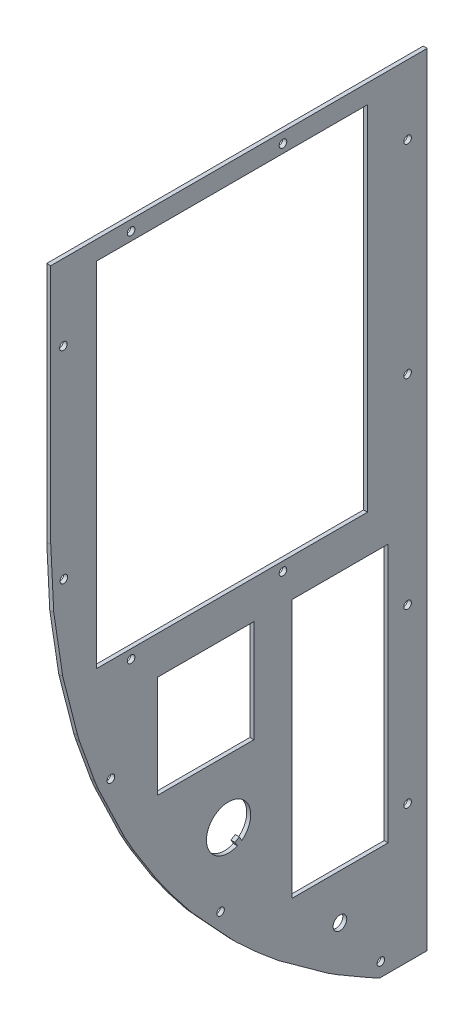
SolidWorks part; units mm, degrees
ref_plane "Front Plane" through (0, 0, 0) normal (0, 0, 1) x (1, 0, 0)
ref_plane "Top Plane" through (0, 0, 0) normal (0, 1, 0) x (1, 0, 0)
ref_plane "Right Plane" through (0, 0, 0) normal (1, 0, 0) x (0, 0, -1)
imported_body "Imported3"
sketch "Sketch24" plane through (907.5363, 0, 0) normal (1, 0, 0) x (0, 0, -1)
  line L0 (-956.7646, 777.5826) -> (-956.7646, 357.4852) construction
  line L1 (-767.8712, 86.5849) -> (-766.2647, 86.5849)
  line L2 (-766.2647, 1048.4829) -> (-766.2647, 86.5849) construction
  line L3 (-766.2647, 86.5849) -> (-766.2647, 478.6339)
  line L16 (-854.845, 273.0129) -> (-854.845, 221.7042)
  line L22 (-854.845, 273.0129) -> (-903.105, 273.0129)
  line L36 (-797.8333, 469.1092) -> (-933.7233, 469.1092)
  line L38 (-903.105, 273.0129) -> (-903.105, 221.7042)
  line L40 (-865.7783, 292.0712) -> (-797.8333, 292.0712)
  line L41 (-865.7783, 292.0712) -> (-933.7233, 292.0712)
  line L43 (-853.0265, 1006.6617) -> (-863.5566, 996.9724)
  line L44 (-863.5566, 996.9724) -> (-865.1657, 995.4091)
  line L45 (-865.1657, 995.4091) -> (-885.7523, 973.1495)
  line L46 (-885.7523, 973.1495) -> (-887.2237, 971.377)
  line L47 (-887.2237, 971.377) -> (-896.3096, 959.7875)
  line L48 (-896.3096, 959.7875) -> (-904.0256, 948.9546)
  line L49 (-904.0256, 948.9546) -> (-919.8046, 923.064)
  line L50 (-919.8046, 923.064) -> (-922.9859, 917.0477)
  line L51 (-922.9859, 917.0477) -> (-932.9332, 895.7338)
  line L52 (-932.9332, 895.7338) -> (-934.7132, 891.4084)
  line L53 (-934.7132, 891.4084) -> (-942.3243, 870.2883)
  line L54 (-942.3243, 870.2883) -> (-943.2817, 867.2344)
  line L55 (-943.2817, 867.2344) -> (-950.7474, 837.8479)
  line L56 (-950.7474, 837.8479) -> (-955.2566, 807.8651)
  line L57 (-955.2566, 807.8651) -> (-956.7646, 777.5826)
  line L58 (-956.7646, 777.5826) -> (-956.7646, 357.4852)
  line L59 (-956.7646, 357.4852) -> (-955.2566, 327.2027)
  line L60 (-955.2566, 327.2027) -> (-950.7474, 297.2199)
  line L61 (-950.7474, 297.2199) -> (-943.2817, 267.8334)
  line L62 (-943.2817, 267.8334) -> (-942.3243, 264.7796)
  line L63 (-942.3243, 264.7796) -> (-934.7132, 243.6594)
  line L64 (-934.7132, 243.6594) -> (-932.9332, 239.3341)
  line L65 (-932.9332, 239.3341) -> (-919.8046, 212.0039)
  line L66 (-919.8046, 212.0039) -> (-914.9366, 203.3787)
  line L67 (-914.9366, 203.3787) -> (-904.0256, 186.1132)
  line L68 (-904.0256, 186.1132) -> (-896.3096, 175.2803)
  line L69 (-896.3096, 175.2803) -> (-887.2237, 163.6908)
  line L70 (-887.2237, 163.6908) -> (-885.7523, 161.9184)
  line L71 (-885.7523, 161.9184) -> (-865.1657, 139.6587)
  line L72 (-865.1657, 139.6587) -> (-863.5566, 138.0954)
  line L73 (-863.5566, 138.0954) -> (-853.0265, 128.4062)
  line L74 (-853.0265, 128.4062) -> (-842.4693, 119.5545)
  line L75 (-842.4693, 119.5545) -> (-817.888, 101.8047)
  line L76 (-817.888, 101.8047) -> (-812.6938, 98.508)
  line L77 (-812.6938, 98.508) -> (-796.6892, 89.2356)
  line L78 (-796.6892, 89.2356) -> (-791.6647, 86.5849)
  line L79 (-791.6647, 86.5849) -> (-767.8712, 86.5849)
  line L80 (-767.8712, 86.5849) -> (-767.8712, 1048.4829)
  line L81 (-767.8712, 1048.4829) -> (-791.6647, 1048.4829)
  line L82 (-791.6647, 1048.4829) -> (-812.6938, 1036.5598)
  line L83 (-812.6938, 1036.5598) -> (-817.888, 1033.2631)
  line L84 (-817.888, 1033.2631) -> (-842.4693, 1015.5133)
  line L85 (-842.4693, 1015.5133) -> (-853.0265, 1006.6617)
  line L101 (-956.7646, 478.6339) -> (-956.7646, 357.4852)
  line L102 (-956.7646, 357.4852) -> (-955.2566, 327.2027)
  line L103 (-955.2566, 327.2027) -> (-950.7474, 297.2199)
  line L104 (-950.7474, 297.2199) -> (-943.2817, 267.8334)
  line L105 (-943.2817, 267.8334) -> (-942.3243, 264.7796)
  line L106 (-942.3243, 264.7796) -> (-934.7132, 243.6594)
  line L107 (-934.7132, 243.6594) -> (-932.9332, 239.3341)
  line L108 (-932.9332, 239.3341) -> (-919.8046, 212.0039)
  line L109 (-919.8046, 212.0039) -> (-914.9366, 203.3787)
  line L110 (-914.9366, 203.3787) -> (-904.0256, 186.1132)
  line L111 (-904.0256, 186.1132) -> (-896.3096, 175.2803)
  line L112 (-896.3096, 175.2803) -> (-887.2237, 163.6908)
  line L113 (-887.2237, 163.6908) -> (-885.7523, 161.9184)
  line L114 (-885.7523, 161.9184) -> (-865.1657, 139.6587)
  line L115 (-865.1657, 139.6587) -> (-863.5566, 138.0954)
  line L116 (-863.5566, 138.0954) -> (-853.0265, 128.4062)
  line L117 (-853.0265, 128.4062) -> (-842.4693, 119.5545)
  line L118 (-842.4693, 119.5545) -> (-817.888, 101.8047)
  line L119 (-817.888, 101.8047) -> (-812.6938, 98.508)
  line L120 (-812.6938, 98.508) -> (-796.6892, 89.2356)
  line L121 (-796.6892, 89.2356) -> (-791.6647, 86.5849)
  line L122 (-791.6647, 86.5849) -> (-767.8712, 86.5849)
  line L129 (-933.7233, 292.0712) -> (-933.7233, 469.1092)
  line L130 (-797.8333, 292.0712) -> (-797.8333, 469.1092)
  line L134 (-835.7989, 273.0214) -> (-787.5157, 273.0214)
  line L135 (-903.105, 221.7042) -> (-854.845, 221.7042)
  line L136 (-835.7989, 143.2274) -> (-787.5389, 143.2274)
  line L138 (-860.9292, 181.0285) -> (-862.1628, 183.1652)
  line L139 (-863.1289, 179.7585) -> (-864.3625, 181.8952)
  line L140 (-864.3625, 181.8952) -> (-862.1628, 183.1652)
  line L143 (-835.7989, 143.2274) -> (-835.7989, 273.0214)
  line L145 (-787.5389, 143.2274) -> (-787.5157, 273.0214)
  line L147 (-956.7646, 478.6339) -> (-766.2647, 478.6339)
  line L149 (-835.7989, 143.2274) -> (-787.5157, 143.2274)
  line L150 (-835.7989, 143.2274) -> (-835.7989, 273.0214)
  line L151 (-835.7989, 273.0214) -> (-787.5157, 273.0214)
  line L152 (-787.5157, 143.2274) -> (-787.5157, 273.0214)
  circle A0 centre (-791.143, 93.4741) radius 1.905
  circle A2 centre (-871.557, 155.3674) radius 1.905
  circle A4 centre (-926.5852, 240.6265) radius 1.905
  circle A6 centre (-950.1864, 339.1754) radius 1.905
  circle A8 centre (-950.4147, 440.5339) radius 1.905
  circle A21 centre (-916.4515, 287.4992) radius 1.905
  circle A22 centre (-840.2515, 287.4992) radius 1.905
  circle A23 centre (-916.4515, 473.4272) radius 1.905
  circle A24 centre (-840.2515, 473.4272) radius 1.905
  circle A38 centre (-811.6689, 120.5708) radius 3.429
  arc A39 (-860.9292, 181.0285) -> (-863.1289, 179.7585) centre (-867.5489, 189.9542) ccw
  circle A46 centre (-777.7175, 443.8695) radius 1.905
  circle A47 centre (-777.7175, 342.0214) radius 1.905
  circle A48 centre (-777.7175, 241.7588) radius 1.905
  circle A73 centre (-777.7175, 155.3674) radius 1.905
  point P20 (-791.143, 93.4741)
  point P26 (-871.557, 155.3674)
  point P32 (-926.5852, 240.6265)
  point P38 (-950.1864, 339.1754)
  point P44 (-950.4147, 440.5339)
  point P254 (-811.6689, 120.5708)
  point P258 (-867.5489, 189.9542)
  dimension "D2" = 190.5
  dimension "D7" = 6.858
  dimension "D49" = 11.1125
  dimension "D3" = 392.049
  dimension "D8" = 4.572
  dimension "D9" = 177.038
  dimension "D10" = 135.89
  dimension "D11" = 76.2
  dimension "D12" = 185.928
  dimension "D13" = 185.928
  dimension "D14" = 48.26
  dimension "D15" = 51.3087
  dimension "D16" = 129.794
  dimension "D17" = 48.2832
  dimension "D1" = 0
extrude "Boss-Extrude4" add sketch "Sketch24" along normal blind 2 separate body contours L147 A73 A48 A47 A46 A39 L138 L140 L139 A38 A24 A23 A22 A21 A8 A6 M289 M290 M291 M292 M293 M294 M295 M296 M297 M298 M299 M300 M301 M302 M303 M304 M305 M306 M307 M308 M309 M310 M311
